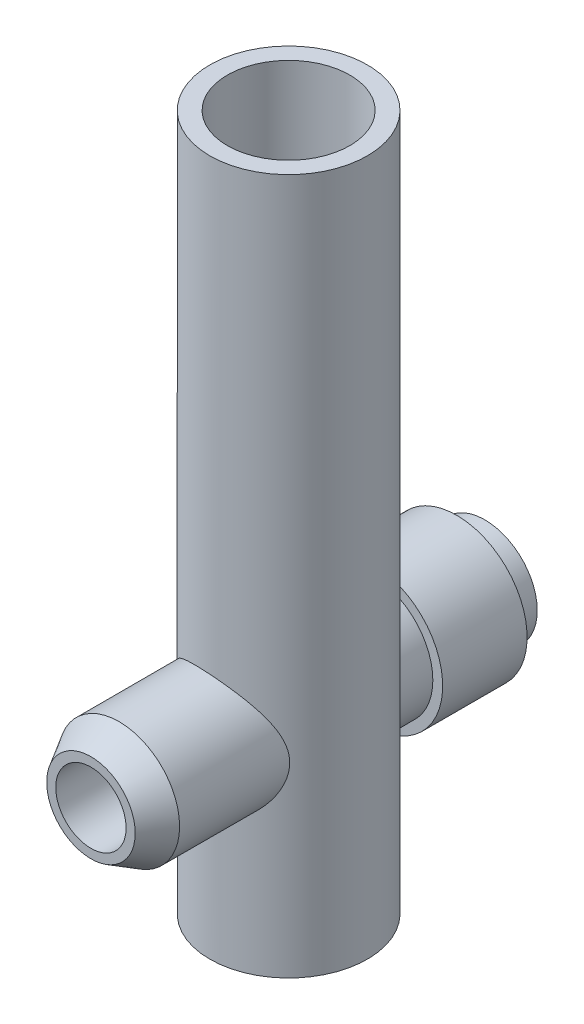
SolidWorks part; units mm, degrees
ref_plane "Front Plane" through (0, 0, 0) normal (0, 0, 1) x (1, 0, 0)
ref_plane "Top Plane" through (0, 0, 0) normal (0, 1, 0) x (1, 0, 0)
ref_plane "Right Plane" through (0, 0, 0) normal (1, 0, 0) x (0, 0, -1)
sketch "Sketch1" plane through (0, 0, 0) normal (0, 0, 1) x (1, 0, 0)
  circle A0 centre (0, 0) radius 4.7244
  dimension "D1" = 9.4488
extrude "inset" add sketch "Sketch1" along normal blind 2.54
sketch "Sketch2" plane through (0, 0, 2.54) normal (0, 0, 1) x (1, 0, 0)
  circle A0 centre (0, 0) radius 6.35
  dimension "D1" = 12.7
extrude "base" add sketch "Sketch2" along normal blind 7.62
sketch "Sketch3" plane through (0, 0, 10.16) normal (0, 0, 1) x (1, 0, 0)
  circle A0 centre (0, 0) radius 5.461
  dimension "D1" = 10.922
extrude "nib" add sketch "Sketch3" along normal blind 25.4
sketch "Sketch4" plane through (0, 0, 35.56) normal (0, 0, 1) x (1, 0, 0)
  circle A0 centre (0, 0) radius 3.175
  dimension "D1" = 6.35
extrude "Cut-Extrude1" cut sketch "Sketch4" against normal through all
sketch "Sketch5" plane through (0, 0, 0) normal (0, 1, 0) x (1, 0, 0)
  line L0 (0, 0) -> (0, -35.56) construction
  line L1 (-5.461, -35.56) -> (5.461, -35.56) construction
  line L2 (-5.461, -10.16) -> (5.461, -10.16) construction
  circle A0 centre (0.381, -18.0975) radius 5.5245 construction
  circle A1 centre (0.381, -18.0975) radius 7.112
  circle A2 centre (0.381, -18.0975) radius 3.175 construction
  dimension "D1" = 11.049
  dimension "D2" = 1.5875
  dimension "D3" = 6.35
  dimension "D4" = 7.9375
  dimension "D5" = 0.762
extrude "Extrude1" add sketch "Sketch5" along normal blind 45.974 and the other way blind 16.8275
sketch "Sketch6" plane through (0, 45.974, 0) normal (0, 1, 0) x (1, 0, 0)
  circle A0 centre (0.381, -18.0975) radius 5.5245
  dimension "D1" = 11.049
extrude "Cut-Extrude2" cut sketch "Sketch6" against normal blind 61.214
chamfer "Chamfer1" distance 2.54 angle 30 1 edges at (5.461, 0, 35.56)
